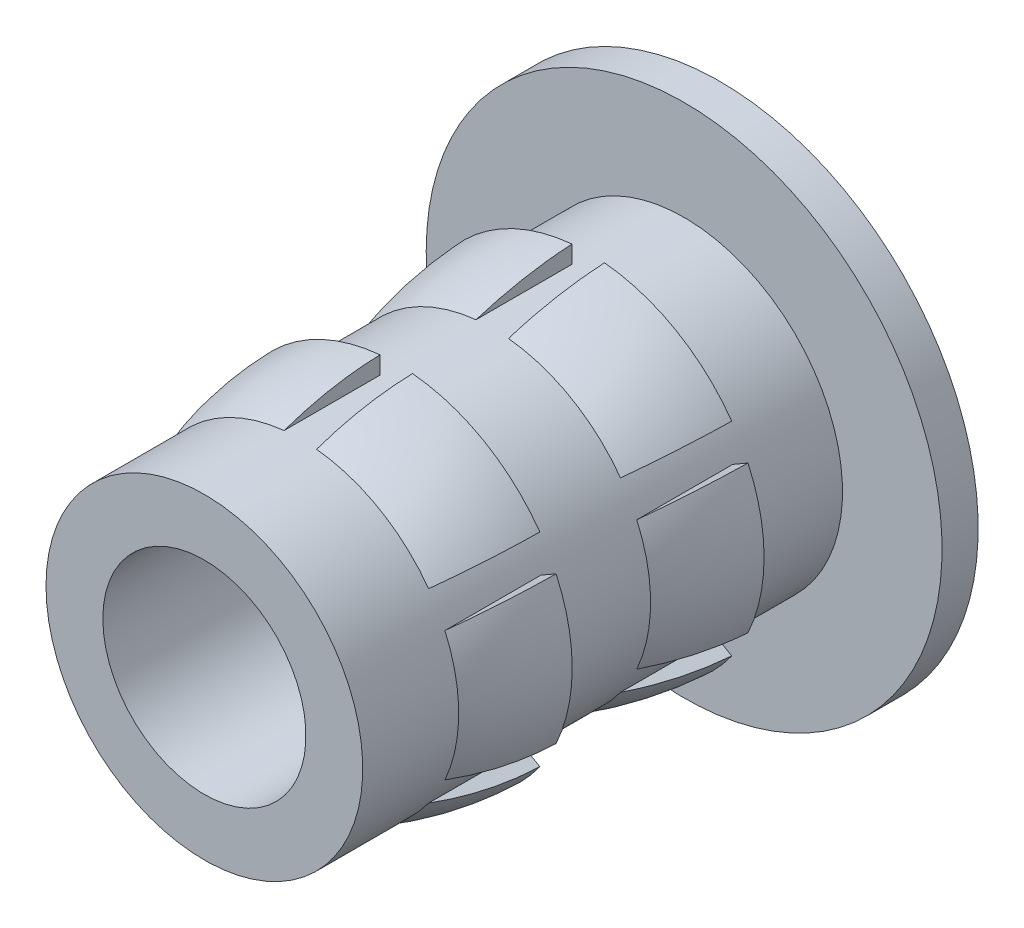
SolidWorks part; units mm, degrees
other "<flanged insert M6>-<M6x1.0 Tapped Hole1>"
ref_plane "Front Plane" through (0, 0, 0) normal (0, 0, 1) x (1, 0, 0)
ref_plane "Top Plane" through (0, 0, 0) normal (0, 1, 0) x (1, 0, 0)
ref_plane "Right Plane" through (0, 0, 0) normal (1, 0, 0) x (0, 0, -1)
inserted part "flanged insert M6"
